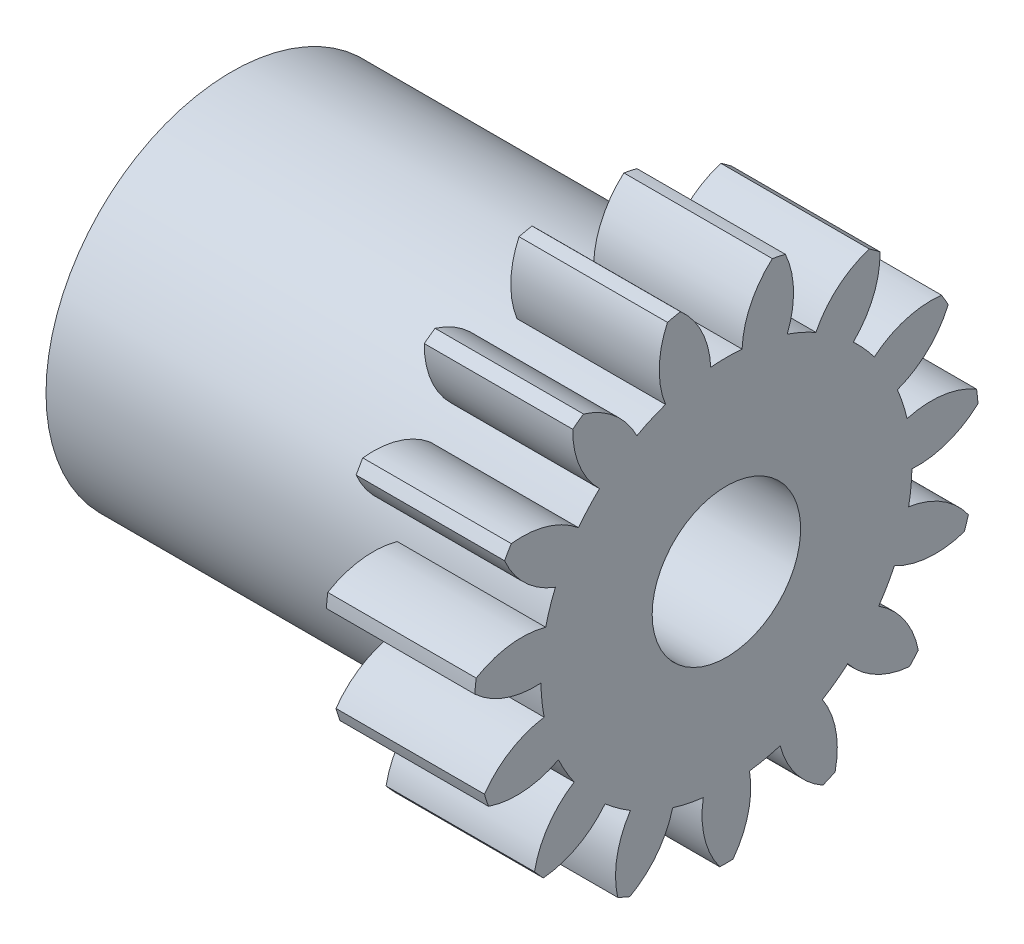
SolidWorks part; units mm, degrees
ref_plane "Plane1" through (0, 0, 0) normal (0, 0, 1) x (1, 0, 0)
ref_plane "Plane2" through (0, 0, 0) normal (0, 1, 0) x (1, 0, 0)
ref_plane "Plane3" through (0, 0, 0) normal (1, 0, 0) x (0, 0, -1)
other "Configuration Table"
sketch "HoldingSke" plane through (0, 0, 0) normal (0, 1, 0) x (1, 0, 0)
  line L0 (0, 0) -> (0.322, -0.0863)
  line L1 (-15, 0) -> (100, 0) construction
  line L2 (0, 0) -> (-2.1039, 2.3779)
  line L3 (0, 0) -> (-11.863, 4.5341)
  line L4 (0, 0) -> (8.3417, 2.2352)
  line L5 (0, 0) -> (-46.8476, -17.4728)
  line L6 (0, 0) -> (-12.4344, -8.3896)
  line L7 (-2.1039, 2.3779) -> (8.6586, 51.2059)
  line L8 (-76.2, 54.61) -> (-73.9, 54.61)
  line L9 (-71.009, 38.7566) -> (-53.1078, 45.2721)
  line L10 (-76.2, 71.12) -> (104.1128, 71.12)
  line L11 (0, 0) -> (-15, 0)
  line L12 (-76.2, 101.6) -> (-76.093, 101.6)
  line L13 (24.9733, 27.94) -> (52.9518, 28.4284)
  line L14 (24.9733, 27.94) -> (24.9743, 27.94)
  line L15 (24.9733, 27.94) -> (100.4006, 29.5858)
  line L16 (-63.627, -3) -> (-12.827, -3)
  circle A0 centre (0, 0) radius 7.5
  circle A1 centre (0, 0) radius 18.749
  circle A2 centre (0, 0) radius 37.5
  circle A3 centre (0, 0) radius 7.5
sketch "BasProSke" plane through (0, 0, 0) normal (0, 1, 0) x (1, 0, 0)
  line L0 (-10, 0) -> (60, 0) construction
  line L1 (0, 0) -> (0, 25.5)
  line L2 (0, 0) -> (15, 0)
  line L3 (15, 0) -> (15, 25.5)
  line L4 (15, 25.5) -> (0, 25.5)
revolve "Base-Revolve" add sketch "BasProSke" angle 360 about L0
sketch "TooCutSke" plane through (0, 0, 0) normal (1, 0, 0) x (0, 0, -1)
  line L1 (0, 0) -> (0, 107) construction
  line L2 (0, 0) -> (-2.539, 22.3563) construction
  line L3 (0, 0) -> (-9.3126, 43.8125) construction
  line L4 (-2.539, 22.3563) -> (-4.6563, 21.9062) construction
  arc A0 (1.5846, 18.6819) -> (-1.5846, 18.6819) centre (0, 0) ccw
  arc A1 (4.6669, 25.0951) -> (-4.6669, 25.0951) centre (0, 0) ccw
  circle A2 centre (0, 0) radius 22.5 construction
  circle A3 centre (0, 0) radius 21.1431 construction
  arc A4 (-1.5846, 18.6819) -> (-4.6669, 25.0951) centre (-10.5768, 18.3074) ccw
  arc A5 (4.6669, 25.0951) -> (1.5846, 18.6819) centre (10.5768, 18.3074) ccw
extrude "ToothCut" cut sketch "TooCutSke" along normal through all
fillet "Breaks" [suppressed] radius 0.06
fillet "RootFillets" [suppressed] radius 0.751
pattern_circular "TeethCuts" count 15 every 24 about axis through (-10, 0, 0) along (1, 0, 0) of "ToothCut"
sketch "HubNeaOneSke" plane through (0, 0, 0) normal (-1, 0, 0) x (0, 0, 1)
  circle A0 centre (0, 0) radius 18.749
extrude "HubNearOne" add sketch "HubNeaOneSke" along normal blind 35.0001
sketch "HubNeaBotSke" plane through (0, 0, 0) normal (-1, 0, 0) x (0, 0, 1)
  circle A0 centre (0, 0) radius 18.749
extrude "HubNearBoth" [suppressed] add sketch "HubNeaBotSke" along normal blind 17.5
ref_plane "FarPln" through (15, 0, 0) normal (1, 0, 0) x (0, 0, -1)
sketch "HubFarSke" plane through (15, 0, 0) normal (1, 0, 0) x (0, 0, -1)
  circle A0 centre (0, 0) radius 18.749
extrude "HubFar" [suppressed] add sketch "HubFarSke" along normal blind 17.5
sketch "BorSke" plane through (0, 0, 0) normal (1, 0, 0) x (0, 0, -1)
  circle A0 centre (0, 0) radius 7.5
extrude "Bore" cut sketch "BorSke" along normal mid plane 100.0001
sketch "KeySke" plane through (0, 0, 0) normal (1, 0, 0) x (0, 0, -1)
  line L0 (-2.5, 0) -> (-2.5, 9.8)
  line L1 (-2.5, 9.8) -> (2.5, 9.8)
  line L2 (2.5, 9.8) -> (2.5, 0)
  line L3 (0, 0) -> (0, 34) construction
  line L4 (-2.5, 0) -> (2.5, 0)
extrude "Keyway" [suppressed] cut sketch "KeySke" along normal mid plane 100.0001
pattern_circular "Keyway2" [suppressed] count 2 every 90 about axis through (-10, 0, 0) along (1, 0, 0)
equation "' \"Module@HoldingSke\" = 6.35"
equation "' \"Num_teeth@HoldingSke\" = 12"
equation "' \"Ap@HoldingSke\" =  20"
equation "' \"Ap@HoldingSke\" = 20"
equation "' \"Width@HoldingSke\" = 0.5 * 25.4"
equation "' \"Hub_dia@HoldingSke\"= 1 * 25.4"
equation "' \"Hub_dia@HoldingSke\" = 1 * 25.4"
equation "' \"Overall_len@HoldingSke\" = 1.0 * 25.4"
equation "' \"Bore@HoldingSke\" = 0.75 * 25.4"
equation "' \"T_dim@HoldingSke\" = 0.1 * 25.4"
equation "' \"Width@KeySke\" = 0.25 * 25.4"
equation "' \"Show_teeth@HoldingSke\" = 13"
equation "' \"Backlash@HoldingSke\" = 0.009 * 25.4"
equation "' \"Addendum_fac@HoldingSke\" = 1.0"
equation "' \"Dedendum_fac@HoldingSke\" = 1.25"
equation "' \"Dedendum_add@HoldingSke\" = 0.00005 * 25.4"
equation "' \"Clearance_fac@HoldingSke\" = 0.25"
equation "\"Pitch@HoldingSke\" = 1 / \"Module@HoldingSke\""
equation "\"Overcut_dia@TooCutSke\" = (\"Num_teeth@HoldingSke\" + 2 * \"Addendum_fac@HoldingSke\") / \"Pitch@HoldingSke\" + 0.002 * 25.4"
equation "\"Pitch_dia@TooCutSke\" = \"Num_teeth@HoldingSke\" / \"Pitch@HoldingSke\""
equation "\"Base_dia@TooCutSke\" = \"Num_teeth@HoldingSke\" / \"Pitch@HoldingSke\" * cos((\"Ap@HoldingSke\"  * 3.14159265 / 180))"
equation "\"Root_dia@TooCutSke\" = (\"Num_teeth@HoldingSke\" + 2) / \"Pitch@HoldingSke\" - 2 * (\"Addendum_fac@HoldingSke\" + \"Dedendum_fac@HoldingSke\") / \"Pitch@HoldingSke\" - \"Dedendum_add@HoldingSke\" * 2"
equation "\"Half_ang@TooCutSke\" = 180 / \"Num_teeth@HoldingSke\""
equation "\"Half_CT@TooCutSke\" = \"Num_teeth@HoldingSke\" / \"Pitch@HoldingSke\" * sin((3.14159265 / 2 / \"Num_teeth@HoldingSke\")) / 2 - 7 * \"Backlash@HoldingSke\" / 4"
equation "\"Flank_rad@TooCutSke\" = \"Num_teeth@HoldingSke\" / \"Pitch@HoldingSke\" / 5"
equation "\"Radius@RootFillets\" = \"Clearance_fac@HoldingSke\" / \"Pitch@HoldingSke\" + \"Dedendum_add@HoldingSke\""
equation "\"Break_rad@Breaks\" = 0.02 / \"Pitch@HoldingSke\""
equation "\"Thickness@HoldingSke\" = \"Width@HoldingSke\""
equation "\"OAL@HoldingSke\" = \"Thickness@HoldingSke\""
equation "\"MHD@HoldingSke\" = (\"Num_teeth@HoldingSke\" + 2) / \"Pitch@HoldingSke\" - 2 * (\"Addendum_fac@HoldingSke\" + \"Dedendum_fac@HoldingSke\")  / \"Pitch@HoldingSke\" - \"Dedendum_add@HoldingSke\" * 2"
equation "\"MBD@HoldingSke\" = (\"Num_teeth@HoldingSke\" + 2) / \"Pitch@HoldingSke\" - 2 * (\"Addendum_fac@HoldingSke\" + \"Dedendum_fac@HoldingSke\")  / \"Pitch@HoldingSke\" - \"Dedendum_add@HoldingSke\" * 2 - 0.002 * 25.4"
equation "\"MHD@HoldingSke\" = ((sgn( \"MHD@HoldingSke\" - \"Hub_dia@HoldingSke\" )-1)*( \"MHD@HoldingSke\" - \"Hub_dia@HoldingSke\" ))/-2+ \"Hub_dia@HoldingSke\""
equation "\"MBD@HoldingSke\" = ((sgn( \"MBD@HoldingSke\" - \"Bore@HoldingSke\" )-1)*( \"MBD@HoldingSke\" - \"Bore@HoldingSke\" ))/-2+ \"Bore@HoldingSke\""
equation "\"OAL@HoldingSke\" = ((sgn( \"OAL@HoldingSke\" - \"Overall_len@HoldingSke\" )+1)*( \"OAL@HoldingSke\" - \"Overall_len@HoldingSke\" ))/2 + \"Overall_len@HoldingSke\" + 0.000002 * 25.4"
equation "\"Num_teeth@TeethCuts\" = int( \"Show_teeth@HoldingSke\" ) + 1"
equation "\"Num_teeth@TeethCuts\" = ((sgn( \"Num_teeth@TeethCuts\" - \"Num_teeth@HoldingSke\" )-1)*( \"Num_teeth@TeethCuts\" - \"Num_teeth@HoldingSke\" ))/-2+ \"Num_teeth@HoldingSke\""
equation "\"Num_teeth@TeethCuts\" = ((sgn( \"Num_teeth@TeethCuts\" - 2.0)+1)*( \"Num_teeth@TeethCuts\" - 2.0))/2 +2.0"
equation "\"Angle@TeethCuts\" = 360.0 / \"Num_teeth@HoldingSke\""
equation "\"Diameter@BasProSke\" = (\"Num_teeth@HoldingSke\" + 2 * \"Addendum_fac@HoldingSke\") / \"Pitch@HoldingSke\""
equation "\"Thickness@BasProSke\"  = \"Thickness@HoldingSke\""
equation "' \"Fillet_rad@BasProSke\" =  \"Thickness@HoldingSke\" * 0.05"
equation "' \"Fillet_rad@BasProSke\" = \"Thickness@HoldingSke\" * 0.05"
equation "\"MHD@HoldingSke\" = ((sgn( \"MHD@HoldingSke\" - \"Root_dia@TooCutSke\" )-1)*( \"MHD@HoldingSke\" - \"Root_dia@TooCutSke\" ))/-2+ \"Root_dia@TooCutSke\""
equation "\"Diameter@HubNeaOneSke\" = \"MHD@HoldingSke\""
equation "\"Length@HubNearOne\" = \"OAL@HoldingSke\" - \"Thickness@BasProSke\""
equation "\"Diameter@HubNeaBotSke\" = \"MHD@HoldingSke\""
equation "\"Length@HubNearBoth\" = ( \"OAL@HoldingSke\" - \"Thickness@BasProSke\" ) / 2.0"
equation "\"Thickness@FarPln\" = \"Thickness@BasProSke\""
equation "\"Diameter@HubFarSke\" = \"MHD@HoldingSke\""
equation "\"Length@HubFar\" = ( \"OAL@HoldingSke\" - \"Thickness@BasProSke\" ) / 2.0"
equation "\"Diameter@BorSke\" = \"MBD@HoldingSke\""
equation "\"D1@Bore\" = \"OAL@HoldingSke\" * 2.0"
equation "\"D1@Keyway\" = \"OAL@HoldingSke\" * 2.0"
equation "\"Offset@KeySke\" = \"T_dim@HoldingSke\" + \"MBD@HoldingSke\" / 2.0"
